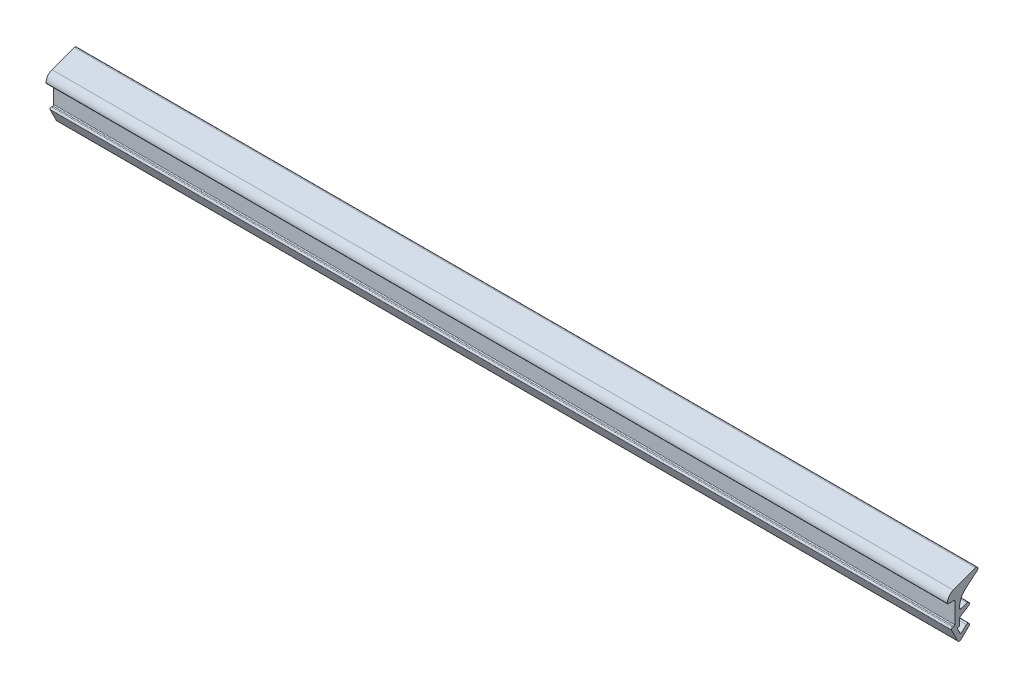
SolidWorks part; units mm, degrees
ref_plane "Front Plane" through (0, 0, 0) normal (0, 0, 1) x (1, 0, 0)
ref_plane "Top Plane" through (0, 0, 0) normal (0, 1, 0) x (1, 0, 0)
ref_plane "Right Plane" through (0, 0, 0) normal (1, 0, 0) x (0, 0, -1)
sketch3d "3DSketch1"
  line L0 (0, 0, 0) -> (200, 0, 0)
  dimension "D1" = 200
other "Paneelitiivisteet 1.6022 PANEELITIIVISTE 6(1)"
ref_plane "Plane1" through (0, 0, 0) normal (1, 0, 0) x (0, 0, -1)
sketch "Sketch1" plane through (0, 0, 0) normal (1, 0, 0) x (0, 0, -1)
  line L0 (1.5884, 3.7605) -> (4.1167, 5.882)
  line L1 (3.7228, 6.5643) -> (-1.2245, 4.7636)
  line L2 (-2.3446, 2.6884) -> (-1.0404, 2.6884)
  line L3 (-0.8404, 2.4884) -> (-0.8404, -2.1116)
  line L4 (-1.0404, -2.3116) -> (-1.3404, -2.3116)
  line L5 (-1.6097, -2.7439) -> (-0.2892, -5.432)
  line L6 (0.507, -5.5712) -> (2.2375, -3.8993)
  line L7 (1.6816, -3.3239) -> (0.5958, -4.373)
  line L8 (0.2773, -4.3173) -> (-0.2716, -3.1998)
  line L9 (-0.0921, -2.9116) -> (-0.0904, -2.9116)
  line L10 (0.1596, -2.6616) -> (0.1596, -1.3743)
  line L11 (0.3006, -1.1199) -> (2.1715, 0.0492)
  line L12 (1.8228, 0.7643) -> (0.5622, 0.3055)
  line L13 (0.1596, 0.5874) -> (0.1596, 0.6963)
  arc A0 (4.1167, 5.882) -> (3.7228, 6.5643) centre (3.8596, 6.1884) ccw
  arc A1 (-1.2245, 4.7636) -> (-2.5404, 2.8843) centre (-0.5404, 2.8843) ccw
  arc A2 (-2.5404, 2.8843) -> (-2.3446, 2.6884) centre (-2.3446, 2.8843) ccw
  arc A3 (-0.8404, 2.4884) -> (-1.0404, 2.6884) centre (-1.0404, 2.4884) ccw
  arc A4 (-1.0404, -2.3116) -> (-0.8404, -2.1116) centre (-1.0404, -2.1116) ccw
  arc A5 (-1.3404, -2.3116) -> (-1.6097, -2.7439) centre (-1.3404, -2.6116) ccw
  arc A6 (-0.2892, -5.432) -> (0.507, -5.5712) centre (0.1596, -5.2116) ccw
  arc A7 (2.2375, -3.8993) -> (1.6816, -3.3239) centre (1.9596, -3.6116) ccw
  arc A8 (0.2773, -4.3173) -> (0.5958, -4.373) centre (0.4568, -4.2291) ccw
  arc A9 (-0.0921, -2.9116) -> (-0.2716, -3.1998) centre (-0.0921, -3.1116) ccw
  arc A10 (-0.0904, -2.9116) -> (0.1596, -2.6616) centre (-0.0904, -2.6616) ccw
  arc A11 (0.3006, -1.1199) -> (0.1596, -1.3743) centre (0.4596, -1.3743) ccw
  arc A12 (2.1715, 0.0492) -> (1.8228, 0.7643) centre (1.9596, 0.3884) ccw
  arc A13 (0.1596, 0.5874) -> (0.5622, 0.3055) centre (0.4596, 0.5874) ccw
  arc A14 (1.5884, 3.7605) -> (0.1596, 0.6963) centre (4.1596, 0.6963) ccw
  point P44 (0, 0)
